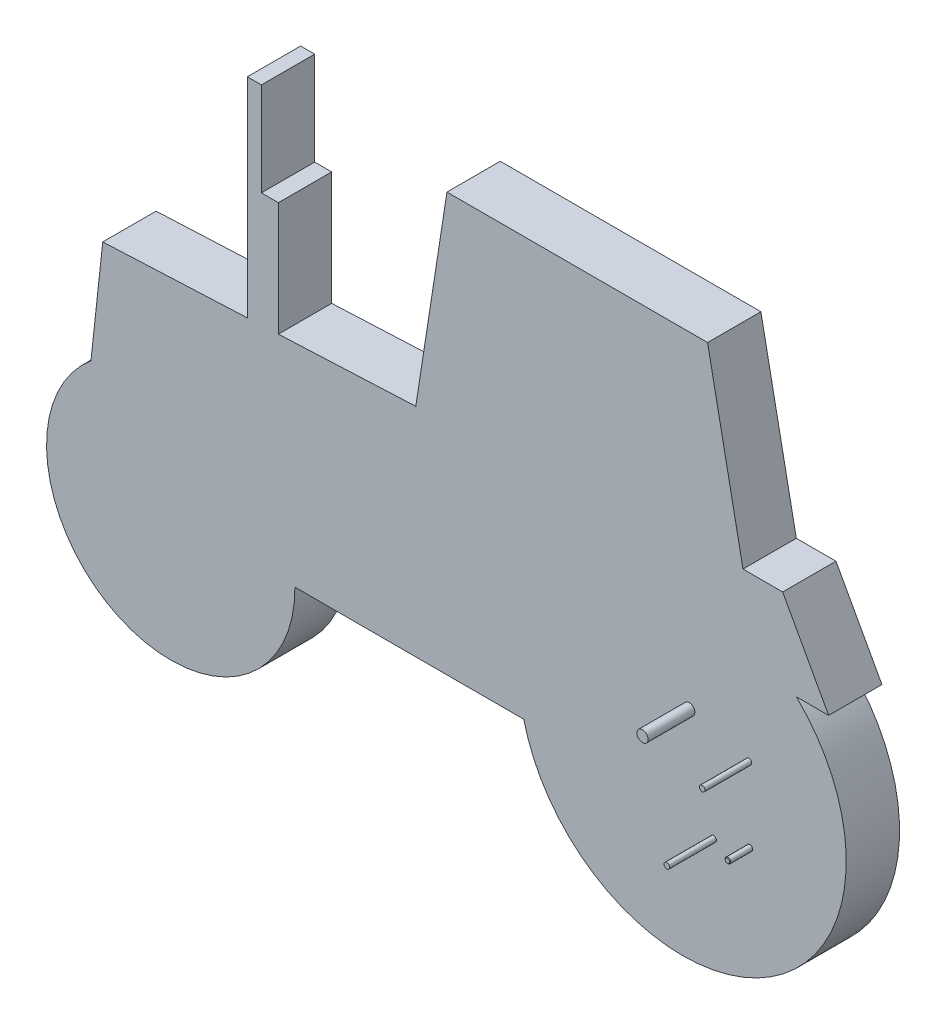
SolidWorks part; units mm, degrees
ref_plane "Plan de face" through (0, 0, 0) normal (0, 0, 1) x (1, 0, 0)
ref_plane "Plan de dessus" through (0, 0, 0) normal (0, 1, 0) x (1, 0, 0)
ref_plane "Plan de droite" through (0, 0, 0) normal (1, 0, 0) x (0, 0, -1)
sketch "Esquisse1" plane through (0, 0, 0) normal (0, 0, 1) x (1, 0, 0)
  line L0 (-18.2589, -48.8402) -> (24.6681, -48.8402)
  line L1 (-56.5127, -31.1999) -> (-54.3034, -10.79)
  line L2 (-54.3034, -10.79) -> (4.4154, -8.133)
  line L3 (4.4154, -8.133) -> (10.2607, 29.5958)
  line L4 (10.2607, 29.5958) -> (59.1488, 29.5958)
  line L5 (59.1488, 29.5958) -> (65.7912, -3.8819)
  line L6 (65.7912, -3.8819) -> (73.2307, -3.8819)
  line L7 (73.2307, -3.8819) -> (81.8556, -19.6191)
  line L8 (81.8556, -19.6191) -> (75.8043, -19.6191)
  line L9 (-27.1858, -9.5629) -> (-27.1858, 29.5958)
  line L10 (-27.1858, 29.5958) -> (-24.5454, 29.5958)
  line L11 (-24.5454, 29.5958) -> (-24.5454, 12.0599)
  line L12 (-24.5454, 12.0599) -> (-21.3571, 12.0599)
  line L13 (-21.3571, 12.0599) -> (-21.3571, -9.2992)
  line L14 (-61.4058, -72.3422) -> (88.9194, -72.3422) construction
  circle A0 centre (-41.55, -49.0502) radius 23.292
  circle A1 centre (54.4889, -41.6719) radius 30.6703
extrude "Extrusion1" add sketch "Esquisse1" along normal blind 10 contours A0 | A1 | A1 L8 L7 L6 L5 L4 L3 L2 L1 A0 L0 | L13 L12 L11 L10 L9 L2
scale "Echelle1" scale about centroid uniform scaling yes scale factor 28.5
sketch "Esquisse2" plane through (0, 0, 147.5) normal (0, 0, 1) x (1, 0, 0)
  circle A0 centre (1264.323, -724.9312) radius 15
  circle A1 centre (1134.323, -189.9312) radius 30
  circle A2 centre (1453.323, -272.9312) radius 15
  dimension "D1" = 30
  dimension "D4" = 60
  dimension "D7" = 30
  dimension "D2" = 165
  dimension "D3" = 250
  dimension "D5" = 285
  dimension "D6" = 35
  dimension "D8" = 202
  dimension "D9" = 354
extrude "Extrusion2" add sketch "Esquisse2" along normal blind 250
sketch "Esquisse3" plane through (0, 0, 147.5) normal (0, 0, 1) x (1, 0, 0)
  line L0 (1343.2914, -169.3357) -> (1343.2914, -763.1546) construction
  circle A0 centre (1458.2914, -669.9312) radius 15
  dimension "D1" = 30
  dimension "D2" = 115
  dimension "D3" = 480
extrude "Extrusion3" add sketch "Esquisse3" along normal blind 120
chamfer "Chanfrein1" distance 3 angle 45 1 edges at (1473.2914, -669.9312, 267.5)
